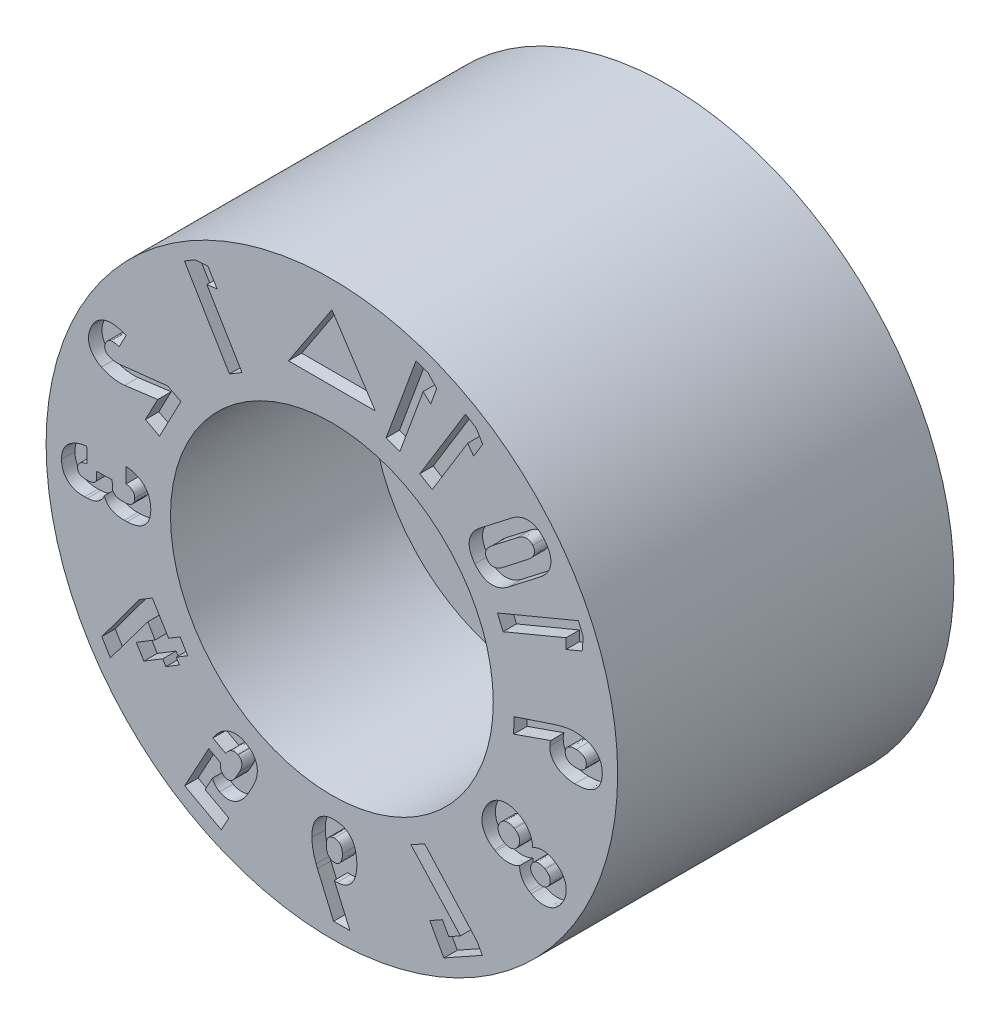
SolidWorks part; units mm, degrees
ref_plane "Front Plane" through (0, 0, 0) normal (0, 0, 1) x (1, 0, 0)
ref_plane "Top Plane" through (0, 0, 0) normal (0, 1, 0) x (1, 0, 0)
ref_plane "Right Plane" through (0, 0, 0) normal (1, 0, 0) x (0, 0, -1)
imported_body "Imported1"
other "Move Face1" parameters "D1"=0.18
other "DeleteFace1"
sketch "Sketch1" plane through (0, 0, 0) normal (0, 0, 1) x (1, 0, 0)
  line L0 (0, 0) -> (5.5475, 3.2028) construction
  line L1 (0, 0) -> (6.4057, 0) construction
  line L2 (0, 0) -> (5.5475, -3.2028) construction
  line L3 (0, 0) -> (3.2028, -5.5475) construction
  line L4 (0, 0) -> (0, -6.4057) construction
  line L5 (0, -2.75) -> (0, 2.75) construction
  line L6 (0, 0) -> (-3.2028, -5.5475) construction
  line L7 (0, 0) -> (-5.5475, -3.2028) construction
  line L8 (0, 0) -> (-6.4057, 0) construction
  line L9 (0, 0) -> (-5.5475, 3.2028) construction
  line L10 (0, 0) -> (-3.2028, 5.5475) construction
  line L11 (0, 0) -> (0, 6.4057) construction
  line L12 (0, 0) -> (3.2028, 5.5475) construction
  line L13 (2.4617, 1.1808) -> (2.5452, 0.981)
  line L14 (2.5452, 0.981) -> (3.483, 1.3721)
  line L15 (3.483, 1.3721) -> (3.4811, 1.2202)
  line L16 (3.4811, 1.2202) -> (3.7222, 1.3209)
  line L17 (3.7222, 1.3209) -> (3.7373, 1.5127)
  line L18 (3.7373, 1.5127) -> (3.666, 1.6833)
  line L19 (3.666, 1.6833) -> (2.4617, 1.1808)
  line L20 (2.6282, 1.5991) -> (3.093, 1.9591)
  line L21 (2.6694, 2.5061) -> (2.2046, 2.146)
  line L22 (2.3873, 2.0116) -> (2.7535, 2.2954)
  line L23 (2.9102, 2.0933) -> (2.544, 1.8095)
  line L24 (1.3075, 2.3967) -> (1.4912, 2.2839)
  line L25 (1.4912, 2.2839) -> (2.02, 3.1459)
  line L26 (2.02, 3.1459) -> (2.1074, 3.0221)
  line L27 (2.1074, 3.0221) -> (2.2434, 3.2438)
  line L28 (2.2434, 3.2438) -> (2.1435, 3.4073)
  line L29 (2.1435, 3.4073) -> (1.9865, 3.5037)
  line L30 (1.9865, 3.5037) -> (1.3075, 2.3967)
  line L31 (0.8067, 2.608) -> (1.0107, 2.5331)
  line L32 (1.0107, 2.5331) -> (1.3579, 3.4801)
  line L33 (1.3579, 3.4801) -> (1.4694, 3.3757)
  line L34 (1.4694, 3.3757) -> (1.5587, 3.6192)
  line L35 (1.5587, 3.6192) -> (1.4269, 3.7603)
  line L36 (1.4269, 3.7603) -> (1.2525, 3.8242)
  line L37 (1.2525, 3.8242) -> (0.8067, 2.608)
  line L38 (-1.5228, 2.2662) -> (-1.3369, 2.3776)
  line L39 (-1.3369, 2.3776) -> (-1.8588, 3.2492)
  line L40 (-1.8588, 3.2492) -> (-1.7076, 3.2695)
  line L41 (-1.7076, 3.2695) -> (-1.8419, 3.4935)
  line L42 (-1.8419, 3.4935) -> (-2.0344, 3.4809)
  line L43 (-2.0344, 3.4809) -> (-2.1933, 3.3857)
  line L44 (-2.1933, 3.3857) -> (-1.5228, 2.2662)
  line L45 (-2.442, 1.6523) -> (-3.1477, 1.575)
  line L46 (-3.3148, 1.5987) -> (-3.3163, 1.5996)
  line L47 (-3.1648, 1.7956) -> (-3.1639, 1.7952)
  line L48 (-3.1639, 1.7952) -> (-3.0603, 1.993)
  line L49 (-3.0603, 1.993) -> (-3.0612, 1.9933)
  line L50 (-3.4268, 1.4042) -> (-3.4259, 1.4039)
  line L51 (-3.0812, 1.3405) -> (-2.5896, 1.4039)
  line L52 (-2.5896, 1.4039) -> (-2.7731, 1.0542)
  line L53 (-2.7731, 1.0542) -> (-2.5632, 0.9441)
  line L54 (-2.5632, 0.9441) -> (-2.2457, 1.5493)
  line L55 (-2.2457, 1.5493) -> (-2.442, 1.6523)
  line L56 (-3.0647, 0.3041) -> (-3.0604, 0.0816)
  line L57 (-3.0778, -0.1676) -> (-3.1082, -0.168)
  line L58 (-3.2649, -0.0665) -> (-3.267, 0.0302)
  line L59 (-3.267, 0.0302) -> (-3.503, 0.0253)
  line L60 (-3.503, 0.0253) -> (-3.5009, -0.0714)
  line L61 (-3.6333, -0.1598) -> (-3.6558, -0.1602)
  line L62 (-3.6412, 0.0517) -> (-3.6457, 0.2734)
  line L63 (-3.676, -0.392) -> (-3.6368, -0.3912)
  line L64 (-3.0847, -0.3991) -> (-3.0455, -0.3983)
  line L65 (-2.8618, -1.3087) -> (-3.4219, -2.0654)
  line L66 (-3.4219, -2.0654) -> (-3.2941, -2.2759)
  line L67 (-3.2941, -2.2759) -> (-2.7381, -1.5328)
  line L68 (-2.7381, -1.5328) -> (-2.6288, -1.7128)
  line L69 (-2.4688, -1.9761) -> (-2.2678, -1.8539)
  line L70 (-2.2678, -1.8539) -> (-2.3148, -1.7765)
  line L71 (-2.6699, -1.1919) -> (-2.8618, -1.3087)
  line L72 (-2.9092, -1.8831) -> (-2.796, -2.069)
  line L73 (-2.796, -2.069) -> (-2.5158, -1.8987)
  line L74 (-2.144, -1.6728) -> (-2.2571, -1.4869)
  line L75 (-2.2571, -1.4869) -> (-2.4277, -1.5906)
  line L76 (-1.7688, -2.5447) -> (-1.7693, -2.5453)
  line L77 (-1.7693, -2.5453) -> (-1.5783, -2.6491)
  line L78 (-1.5783, -2.6491) -> (-1.5778, -2.6484)
  line L79 (-1.3693, -2.7733) -> (-1.4216, -2.8692)
  line L80 (-1.6532, -2.8094) -> (-1.8313, -2.7125)
  line L81 (-1.8313, -2.7125) -> (-2.189, -3.3704)
  line L82 (-2.189, -3.3704) -> (-1.6455, -3.6659)
  line L83 (-1.6455, -3.6659) -> (-1.5325, -3.4581)
  line L84 (-1.5325, -3.4581) -> (-1.8852, -3.2666)
  line L85 (-1.8852, -3.2666) -> (-1.7753, -3.0643)
  line L86 (-1.2306, -2.9729) -> (-1.1784, -2.877)
  line L87 (-0.2978, -3.0916) -> (-0.2978, -3.0924)
  line L88 (-0.2141, -3.4518) -> (0.0247, -4.0087)
  line L89 (0.0247, -4.0087) -> (0.2684, -4.0057)
  line L90 (0.2684, -4.0057) -> (0.0361, -3.4763)
  line L92 (0.3712, -3.0886) -> (0.3712, -3.0878)
  line L93 (0.1557, -3.0753) -> (0.1558, -3.0761)
  line L94 (-0.0827, -3.0782) -> (-0.0827, -3.0771)
  line L95 (2.1581, -3.1991) -> (1.3797, -2.3336)
  line L96 (1.3797, -2.3336) -> (1.1756, -2.4478)
  line L97 (1.1756, -2.4478) -> (1.9112, -3.2533)
  line L98 (1.9112, -3.2533) -> (1.7392, -3.3495)
  line L99 (1.7392, -3.3495) -> (1.6436, -3.1788)
  line L100 (1.6436, -3.1788) -> (1.4551, -3.2842)
  line L101 (1.4551, -3.2842) -> (1.6655, -3.6604)
  line L102 (1.6655, -3.6604) -> (2.2372, -3.3408)
  line L103 (2.2372, -3.3408) -> (2.1581, -3.1991)
  line L104 (2.4166, -1.8898) -> (2.435, -1.9006)
  line L105 (2.9354, -2.1668) -> (2.9645, -2.1839)
  line L106 (3.3104, -1.5948) -> (3.2812, -1.5777)
  line L107 (2.8049, -1.2704) -> (2.7865, -1.2596)
  line L108 (2.7073, -1.465) -> (2.718, -1.4714)
  line L109 (2.5673, -1.7264) -> (2.5557, -1.7196)
  line L110 (3.163, -1.7601) -> (3.1737, -1.7664)
  line L111 (3.047, -1.9804) -> (3.0354, -1.9735)
  line L113 (3.6121, -0.4436) -> (3.6129, -0.4437)
  line L114 (3.6288, 0.2258) -> (3.628, 0.2256)
  line L115 (3.2724, 0.1562) -> (2.7091, -0.0312)
  line L116 (2.7091, -0.0312) -> (2.7022, -0.2593)
  line L117 (2.7022, -0.2593) -> (3.2542, -0.0658)
  line L118 (3.633, 0.01) -> (3.6338, 0.01)
  line L119 (3.6259, -0.2284) -> (3.6248, -0.2283)
  line L120 (-2.4277, -1.5906) -> (-2.6699, -1.1919)
  line L121 (-2.3148, -1.7765) -> (-2.144, -1.6728)
  line L122 (-2.6288, -1.7128) -> (-2.9092, -1.8831)
  line L123 (-2.5158, -1.8987) -> (-2.4688, -1.9761)
  circle A0 centre (0, 0) radius 2.74 construction
  spline S0 degree 3 poles (2.1259, 1.6475) (2.1424, 1.6265) (2.1681, 1.5971) (2.2068, 1.5643) (2.2359, 1.5444) (2.2657, 1.5279) (2.2964, 1.5155) (2.3283, 1.5074) (2.3607, 1.5027) (2.3937, 1.5023) (2.4269, 1.5052) (2.4603, 1.5117) (2.4937, 1.5222) (2.5274, 1.5358) (2.5735, 1.5599) (2.6066, 1.5824) (2.6282, 1.5991) knots 0 0 0 0 0.139264 0.203206 0.264472 0.322969 0.380626 0.437349 0.493979 0.55136 0.609121 0.667907 0.728572 0.791843 0.857485 1 1 1 1
  spline S1 degree 3 poles (3.093, 1.9591) (3.1148, 1.976) (3.1452, 2.0026) (3.1803, 2.0416) (3.2022, 2.0708) (3.2205, 2.1007) (3.235, 2.1314) (3.2464, 2.1627) (3.2535, 2.1948) (3.2571, 2.2272) (3.2567, 2.2599) (3.2525, 2.2928) (3.2442, 2.3257) (3.2318, 2.3588) (3.2095, 2.4041) (3.1879, 2.4365) (3.1716, 2.4574) knots 0 0 0 0 0.143911 0.210291 0.273547 0.334208 0.392877 0.450716 0.507441 0.564283 0.620638 0.677728 0.736513 0.797761 0.861505 1 1 1 1
  spline S2 degree 3 poles (3.1716, 2.4574) (3.1552, 2.4784) (3.1293, 2.5077) (3.0908, 2.5408) (3.0619, 2.5611) (3.0321, 2.5773) (3.0014, 2.5898) (2.9699, 2.5982) (2.9377, 2.6031) (2.9049, 2.6037) (2.8719, 2.601) (2.8386, 2.5944) (2.8049, 2.5842) (2.7711, 2.5701) (2.7245, 2.5458) (2.6911, 2.5231) (2.6694, 2.5061) knots 0 0 0 0 0.139092 0.203155 0.264071 0.322941 0.380071 0.436264 0.492774 0.549529 0.606631 0.665344 0.726326 0.789796 0.856006 1 1 1 1
  spline S3 degree 3 poles (2.2046, 2.146) (2.1828, 2.1293) (2.1526, 2.1027) (2.1176, 2.0637) (2.0956, 2.0345) (2.0773, 2.0045) (2.0627, 1.9737) (2.0514, 1.9423) (2.0442, 1.9101) (2.0407, 1.8776) (2.0411, 1.8449) (2.0452, 1.8121) (2.0535, 1.7791) (2.0659, 1.7461) (2.0879, 1.7006) (2.1097, 1.6685) (2.1259, 1.6475) knots 0 0 0 0 0.143281 0.209664 0.272921 0.334025 0.392696 0.450537 0.507724 0.564568 0.620925 0.678017 0.736803 0.798054 0.861501 1 1 1 1
  spline S4 degree 3 poles (2.3115, 1.7912) (2.2992, 1.8065) (2.2856, 1.8331) (2.2842, 1.8717) (2.2913, 1.8999) (2.3057, 1.928) (2.3354, 1.9683) (2.3657, 1.9942) (2.3873, 2.0116) knots 0 0 0 0 0.224242 0.325931 0.433422 0.551417 0.683099 1 1 1 1
  spline S5 degree 3 poles (2.7535, 2.2954) (2.7755, 2.3126) (2.8087, 2.3346) (2.8549, 2.3536) (2.8856, 2.3604) (2.9148, 2.3603) (2.9518, 2.349) (2.9743, 2.3295) (2.9859, 2.3137) knots 0 0 0 0 0.318022 0.448766 0.56642 0.673823 0.776322 1 1 1 1
  spline S6 degree 3 poles (2.9859, 2.3137) (2.998, 2.2984) (3.0121, 2.2719) (3.0133, 2.2332) (3.0062, 2.205) (2.9917, 2.177) (2.962, 2.1369) (2.9323, 2.1103) (2.9102, 2.0933) knots 0 0 0 0 0.223374 0.326015 0.433495 0.550497 0.682165 1 1 1 1
  spline S7 degree 3 poles (2.544, 1.8095) (2.5221, 1.7923) (2.4889, 1.7705) (2.4427, 1.7513) (2.4118, 1.7445) (2.3827, 1.7446) (2.3457, 1.7559) (2.3232, 1.7754) (2.3115, 1.7912) knots 0 0 0 0 0.316607 0.448757 0.566413 0.673818 0.776319 1 1 1 1
  spline S8 degree 3 poles (-3.1477, 1.575) (-3.1781, 1.5709) (-3.2356, 1.5713) (-3.2912, 1.5864) (-3.3148, 1.5987) knots 0 0 0 0 0.53629 1 1 1 1
  spline S9 degree 3 poles (-3.3163, 1.5996) (-3.3306, 1.6067) (-3.3494, 1.6205) (-3.3676, 1.6446) (-3.3752, 1.6642) (-3.379, 1.6851) (-3.3766, 1.7161) (-3.368, 1.7389) (-3.3601, 1.7535) knots 0 0 0 0 0.262069 0.378526 0.491859 0.605797 0.72603 1 1 1 1
  spline S10 degree 3 poles (-3.3601, 1.7535) (-3.3527, 1.7685) (-3.3366, 1.788) (-3.3082, 1.8056) (-3.2839, 1.8132) (-3.2569, 1.8164) (-3.2161, 1.8132) (-3.1852, 1.8043) (-3.1648, 1.7956) knots 0 0 0 0 0.225503 0.334502 0.448026 0.568399 0.699521 1 1 1 1
  spline S11 degree 3 poles (-3.0612, 1.9933) (-3.096, 2.0092) (-3.1488, 2.0281) (-3.2201, 2.042) (-3.2703, 2.0458) (-3.3184, 2.0434) (-3.364, 2.0351) (-3.4068, 2.0209) (-3.4468, 2.0009) (-3.4834, 1.9748) (-3.5284, 1.9324) (-3.5546, 1.893) (-3.5694, 1.865) knots 0 0 0 0 0.196173 0.28577 0.371707 0.453588 0.531973 0.608304 0.68414 0.760168 0.837544 1 1 1 1
  spline S12 degree 3 poles (-3.5694, 1.865) (-3.5852, 1.8353) (-3.6037, 1.7896) (-3.6174, 1.7274) (-3.6207, 1.6833) (-3.618, 1.6407) (-3.6088, 1.5998) (-3.5934, 1.5611) (-3.5718, 1.5243) (-3.544, 1.49) (-3.498, 1.446) (-3.4564, 1.4198) (-3.4268, 1.4042) knots 0 0 0 0 0.184045 0.267802 0.347881 0.425458 0.500482 0.575862 0.652921 0.732871 0.816751 1 1 1 1
  spline S13 degree 3 poles (-3.4259, 1.4039) (-3.3995, 1.3904) (-3.3586, 1.3723) (-3.3014, 1.3553) (-3.2571, 1.3459) (-3.2126, 1.3389) (-3.1538, 1.3352) (-3.11, 1.3367) (-3.0812, 1.3405) knots 0 0 0 0 0.249796 0.37589 0.503414 0.630939 0.755521 1 1 1 1
  spline S14 degree 3 poles (-2.6934, -0.0551) (-2.6939, -0.0221) (-2.7, 0.0264) (-2.7194, 0.0875) (-2.7392, 0.1291) (-2.7639, 0.1674) (-2.7936, 0.2016) (-2.8285, 0.2311) (-2.8676, 0.2567) (-2.9115, 0.2768) (-2.9767, 0.2976) (-3.0292, 0.3029) (-3.0647, 0.3041) knots 0 0 0 0 0.170915 0.251711 0.331349 0.409597 0.487148 0.565266 0.646102 0.729077 0.814865 1 1 1 1
  spline S15 degree 3 poles (-3.0604, 0.0816) (-3.0479, 0.0799) (-3.0294, 0.0772) (-3.0068, 0.0693) (-2.9917, 0.0623) (-2.9785, 0.0537) (-2.9664, 0.0444) (-2.9561, 0.0336) (-2.9476, 0.0216) (-2.9406, 0.0087) (-2.9342, -0.0105) (-2.9317, -0.0257) (-2.9317, -0.0362) knots 0 0 0 0 0.197555 0.28767 0.373146 0.455135 0.533119 0.610067 0.685564 0.761808 0.837915 1 1 1 1
  spline S16 degree 3 poles (-2.9317, -0.0362) (-2.9317, -0.0546) (-2.9346, -0.0822) (-2.9513, -0.1137) (-2.9686, -0.1327) (-2.99, -0.1482) (-3.0263, -0.1631) (-3.0566, -0.1675) (-3.0778, -0.1676) knots 0 0 0 0 0.249641 0.362623 0.475304 0.592053 0.715501 1 1 1 1
  spline S17 degree 3 poles (-3.1082, -0.168) (-3.1303, -0.1687) (-3.1618, -0.1665) (-3.2003, -0.1557) (-3.2231, -0.1442) (-3.2415, -0.1294) (-3.2599, -0.1049) (-3.2643, -0.0817) (-3.2649, -0.0665) knots 0 0 0 0 0.314439 0.447609 0.567871 0.677707 0.781218 1 1 1 1
  spline S18 degree 3 poles (-3.5009, -0.0714) (-3.5005, -0.084) (-3.5045, -0.1032) (-3.5198, -0.1238) (-3.5354, -0.1363) (-3.5547, -0.1467) (-3.5875, -0.1566) (-3.6144, -0.1596) (-3.6333, -0.1598) knots 0 0 0 0 0.212717 0.315296 0.425563 0.547852 0.681966 1 1 1 1
  spline S19 degree 3 poles (-3.6558, -0.1602) (-3.6736, -0.1604) (-3.6994, -0.1591) (-3.7304, -0.1488) (-3.7489, -0.1381) (-3.7638, -0.1246) (-3.7787, -0.1022) (-3.7828, -0.082) (-3.7829, -0.0684) knots 0 0 0 0 0.302489 0.430837 0.549934 0.662062 0.76879 1 1 1 1
  spline S20 degree 3 poles (-3.7829, -0.0684) (-3.7835, -0.0588) (-3.7808, -0.0449) (-3.7745, -0.0271) (-3.7672, -0.0146) (-3.7578, -0.0029) (-3.7468, 0.0081) (-3.7334, 0.0178) (-3.7184, 0.027) (-3.7015, 0.035) (-3.6759, 0.0445) (-3.6553, 0.049) (-3.6412, 0.0517) knots 0 0 0 0 0.140018 0.20799 0.27907 0.353221 0.429103 0.509956 0.596543 0.689056 0.786611 1 1 1 1
  spline S21 degree 3 poles (-3.6457, 0.2734) (-3.6831, 0.2697) (-3.7374, 0.2601) (-3.8049, 0.2363) (-3.8497, 0.2143) (-3.8899, 0.1883) (-3.925, 0.1586) (-3.9552, 0.1255) (-3.9797, 0.0889) (-3.9986, 0.0494) (-4.0169, -0.0067) (-4.0211, -0.0513) (-4.0205, -0.081) knots 0 0 0 0 0.196756 0.287394 0.374446 0.457889 0.537714 0.61497 0.691823 0.767827 0.843846 1 1 1 1
  spline S22 degree 3 poles (-4.0205, -0.081) (-4.02, -0.105) (-4.0171, -0.1401) (-4.0064, -0.1847) (-3.9963, -0.215) (-3.9834, -0.2432) (-3.9677, -0.2693) (-3.9491, -0.293) (-3.928, -0.3145) (-3.9043, -0.3334) (-3.8784, -0.35) (-3.85, -0.3636) (-3.8196, -0.375) (-3.7869, -0.3833) (-3.739, -0.3913) (-3.7015, -0.3923) (-3.676, -0.392) knots 0 0 0 0 0.1363 0.199178 0.259829 0.317878 0.37514 0.431951 0.488787 0.546041 0.604081 0.663346 0.724289 0.788255 0.854873 1 1 1 1
  spline S23 degree 3 poles (-3.6368, -0.3912) (-3.6085, -0.3905) (-3.5665, -0.3856) (-3.5148, -0.367) (-3.4799, -0.3489) (-3.4489, -0.326) (-3.4124, -0.2896) (-3.3925, -0.2559) (-3.3824, -0.232) knots 0 0 0 0 0.268071 0.393627 0.516103 0.636592 0.755557 1 1 1 1
  spline S24 degree 3 poles (-3.3824, -0.232) (-3.3785, -0.2452) (-3.3716, -0.2647) (-3.3578, -0.2883) (-3.3461, -0.3048) (-3.3324, -0.3199) (-3.317, -0.3337) (-3.3001, -0.3465) (-3.2749, -0.362) (-3.2395, -0.378) (-3.1739, -0.3961) (-3.1211, -0.4001) (-3.0847, -0.3991) knots 0 0 0 0 0.112304 0.166591 0.221569 0.276649 0.332004 0.38966 0.448621 0.572598 0.704095 1 1 1 1
  spline S25 degree 3 poles (-3.0455, -0.3983) (-3.0103, -0.3976) (-2.9589, -0.3924) (-2.8947, -0.3742) (-2.8525, -0.356) (-2.8147, -0.3332) (-2.7816, -0.3059) (-2.7537, -0.2739) (-2.731, -0.2376) (-2.7131, -0.1974) (-2.6964, -0.1366) (-2.6926, -0.0881) (-2.6934, -0.0551) knots 0 0 0 0 0.189492 0.275414 0.357234 0.435772 0.51156 0.586704 0.662739 0.741001 0.822287 1 1 1 1
  spline S26 degree 3 poles (-1.286, -2.3634) (-1.3119, -2.3488) (-1.3536, -2.333) (-1.4115, -2.3238) (-1.4548, -2.3234) (-1.4982, -2.3291) (-1.5411, -2.3414) (-1.5833, -2.3601) (-1.6243, -2.3853) (-1.6641, -2.4164) (-1.7156, -2.4674) (-1.7487, -2.5123) (-1.7688, -2.5447) knots 0 0 0 0 0.155357 0.230238 0.305532 0.381121 0.458378 0.53785 0.62191 0.709523 0.800975 1 1 1 1
  spline S27 degree 3 poles (-1.5778, -2.6484) (-1.5655, -2.6307) (-1.5465, -2.6056) (-1.5149, -2.5809) (-1.4914, -2.5685) (-1.4675, -2.561) (-1.4349, -2.5589) (-1.4112, -2.5662) (-1.3971, -2.5742) knots 0 0 0 0 0.300378 0.430531 0.552154 0.666768 0.774669 1 1 1 1
  spline S28 degree 3 poles (-1.3971, -2.5742) (-1.3817, -2.5823) (-1.3613, -2.5989) (-1.3451, -2.629) (-1.3388, -2.6539) (-1.3379, -2.6813) (-1.3451, -2.7227) (-1.3582, -2.7531) (-1.3693, -2.7733) knots 0 0 0 0 0.229451 0.336013 0.447885 0.566223 0.695184 1 1 1 1
  spline S29 degree 3 poles (-1.4216, -2.8692) (-1.4323, -2.8893) (-1.4503, -2.9167) (-1.4797, -2.9458) (-1.5017, -2.9605) (-1.5243, -2.9698) (-1.5555, -2.973) (-1.5784, -2.9669) (-1.5919, -2.959) knots 0 0 0 0 0.3165 0.449949 0.571115 0.681043 0.785033 1 1 1 1
  spline S30 degree 3 poles (-1.5919, -2.959) (-1.6046, -2.9519) (-1.6226, -2.9391) (-1.6398, -2.9162) (-1.6497, -2.8977) (-1.6557, -2.8772) (-1.6597, -2.8475) (-1.6569, -2.8245) (-1.6532, -2.8094) knots 0 0 0 0 0.251575 0.369942 0.488434 0.609601 0.733459 1 1 1 1
  spline S31 degree 3 poles (-1.7753, -3.0643) (-1.7724, -3.0766) (-1.7645, -3.0946) (-1.7504, -3.1172) (-1.7369, -3.134) (-1.7217, -3.1497) (-1.7002, -3.1688) (-1.6826, -3.1809) (-1.6701, -3.1875) knots 0 0 0 0 0.227923 0.350723 0.482106 0.615334 0.746107 1 1 1 1
  spline S32 degree 3 poles (-1.6701, -3.1875) (-1.6457, -3.2012) (-1.6067, -3.2161) (-1.5526, -3.223) (-1.513, -3.221) (-1.4738, -3.2122) (-1.4354, -3.1968) (-1.3979, -3.1749) (-1.3613, -3.1467) (-1.3262, -3.1119) (-1.2794, -3.0556) (-1.2493, -3.0073) (-1.2306, -2.9729) knots 0 0 0 0 0.152182 0.224111 0.295102 0.366811 0.441203 0.519083 0.602421 0.691597 0.787124 1 1 1 1
  spline S33 degree 3 poles (-1.1784, -2.877) (-1.1602, -2.8423) (-1.1356, -2.7904) (-1.1168, -2.7189) (-1.1093, -2.669) (-1.1083, -2.621) (-1.1145, -2.5755) (-1.1268, -2.5323) (-1.146, -2.4919) (-1.1717, -2.4544) (-1.2153, -2.4071) (-1.2567, -2.3795) (-1.286, -2.3634) knots 0 0 0 0 0.198012 0.287153 0.37167 0.451892 0.528131 0.602464 0.676978 0.752647 0.830779 1 1 1 1
  spline S34 degree 3 poles (0.0318, -2.6949) (-0.0012, -2.6949) (-0.0493, -2.701) (-0.1092, -2.7211) (-0.1487, -2.7422) (-0.1842, -2.7683) (-0.2152, -2.8) (-0.2411, -2.8371) (-0.2624, -2.8791) (-0.2789, -2.9259) (-0.2952, -2.9967) (-0.2981, -3.053) (-0.2978, -3.0916) knots 0 0 0 0 0.168766 0.246642 0.322553 0.397273 0.471855 0.548534 0.628334 0.712731 0.801986 1 1 1 1
  spline S35 degree 3 poles (-0.2978, -3.0924) (-0.2975, -3.1167) (-0.295, -3.1537) (-0.2883, -3.2034) (-0.273, -3.2825) (-0.2545, -3.3479) (-0.2352, -3.3991) knots 0 0 0 0 0.231959 0.353197 0.478693 1 1 1 1
  spline S36 degree 3 poles (-0.2352, -3.3991) (-0.2323, -3.4083) (-0.2252, -3.4259) (-0.2179, -3.4434) (-0.2141, -3.4518) knots 0 0 0 0 0.508512 1 1 1 1
  spline S37 degree 3 poles (0.0361, -3.4763) (0.0499, -3.4794) (0.064, -3.4807) (0.0781, -3.4805) knots 0.765711 0.765711 0.765711 0.765711 1 1 1 1
  spline S38 degree 3 poles (0.0781, -3.4805) (0.1075, -3.48) (0.151, -3.4748) (0.2042, -3.4545) (0.2394, -3.4338) (0.2711, -3.408) (0.2978, -3.3762) (0.3216, -3.3401) (0.3401, -3.2984) (0.355, -3.2523) (0.3686, -3.1821) (0.3717, -3.1267) (0.3712, -3.0886) knots 0 0 0 0 0.159826 0.233979 0.30722 0.380154 0.45434 0.531445 0.613402 0.700561 0.793767 1 1 1 1
  spline S39 degree 3 poles (0.3712, -3.0878) (0.3712, -3.0488) (0.3656, -2.9923) (0.3486, -2.9209) (0.3307, -2.874) (0.3084, -2.8319) (0.2812, -2.7952) (0.2498, -2.7637) (0.2137, -2.7382) (0.1737, -2.718) (0.1133, -2.6988) (0.0648, -2.6943) (0.0318, -2.6949) knots 0 0 0 0 0.198581 0.287923 0.37282 0.453452 0.529919 0.604649 0.678836 0.754265 0.831904 1 1 1 1
  spline S40 degree 3 poles (0.0346, -2.9309) (0.0518, -2.9305) (0.0775, -2.9343) (0.1068, -2.9507) (0.1243, -2.9676) (0.1384, -2.9887) (0.152, -3.0246) (0.1556, -3.0545) (0.1557, -3.0753) knots 0 0 0 0 0.242651 0.353813 0.465986 0.581856 0.70733 1 1 1 1
  spline S41 degree 3 poles (0.1558, -3.0761) (0.1561, -3.1) (0.1536, -3.1344) (0.1406, -3.1759) (0.1274, -3.2006) (0.1102, -3.2204) (0.0816, -3.2398) (0.0555, -3.2446) (0.0382, -3.2449) knots 0 0 0 0 0.309802 0.440421 0.559006 0.6696 0.775302 1 1 1 1
  spline S42 degree 3 poles (0.0382, -3.2449) (0.0211, -3.245) (-0.005, -3.2405) (-0.0337, -3.2214) (-0.0512, -3.2016) (-0.0653, -3.1771) (-0.079, -3.1359) (-0.0828, -3.1019) (-0.0827, -3.0782) knots 0 0 0 0 0.223197 0.329061 0.440845 0.562032 0.692834 1 1 1 1
  spline S43 degree 3 poles (-0.0827, -3.0771) (-0.0828, -3.0565) (-0.0806, -3.0265) (-0.0674, -2.9907) (-0.0536, -2.9694) (-0.0367, -2.9519) (-0.0077, -2.9355) (0.0174, -2.9306) (0.0346, -2.9309) knots 0 0 0 0 0.292568 0.417776 0.535306 0.647259 0.758264 1 1 1 1
  spline S44 degree 3 poles (2.2914, -1.3926) (2.2742, -1.4224) (2.2523, -1.4686) (2.2365, -1.5333) (2.2316, -1.5804) (2.233, -1.6268) (2.2409, -1.6716) (2.255, -1.7148) (2.2759, -1.7558) (2.3024, -1.7944) (2.3466, -1.843) (2.3872, -1.8728) (2.4166, -1.8898) knots 0 0 0 0 0.179216 0.263098 0.344899 0.424707 0.503046 0.580641 0.659998 0.740899 0.823451 1 1 1 1
  spline S45 degree 3 poles (2.435, -1.9006) (2.4623, -1.9165) (2.5061, -1.936) (2.5685, -1.9489) (2.6162, -1.9529) (2.6635, -1.951) (2.7239, -1.9407) (2.7662, -1.9232) (2.7921, -1.9081) knots 0 0 0 0 0.254268 0.380657 0.509625 0.637065 0.759654 1 1 1 1
  spline S46 degree 3 poles (2.7921, -1.9081) (2.7912, -1.9335) (2.7952, -1.9721) (2.8112, -2.0213) (2.8283, -2.0567) (2.8492, -2.0901) (2.8826, -2.1298) (2.9132, -2.1538) (2.9354, -2.1668) knots 0 0 0 0 0.24673 0.371571 0.49906 0.626963 0.75144 1 1 1 1
  spline S47 degree 3 poles (2.9645, -2.1839) (2.992, -2.2005) (3.0353, -2.2198) (3.0955, -2.2344) (3.1396, -2.2384) (3.1829, -2.2366) (3.2251, -2.2292) (3.2656, -2.2153) (3.3042, -2.1956) (3.3404, -2.17) (3.3866, -2.1283) (3.414, -2.089) (3.4307, -2.0615) knots 0 0 0 0 0.177147 0.260228 0.341479 0.421197 0.498869 0.57737 0.656946 0.738211 0.821577 1 1 1 1
  spline S48 degree 3 poles (3.4307, -2.0615) (3.447, -2.0336) (3.4673, -1.9903) (3.4817, -1.9296) (3.4862, -1.8853) (3.4843, -1.842) (3.477, -1.7999) (3.463, -1.7596) (3.4437, -1.7208) (3.4181, -1.6847) (3.3765, -1.6389) (3.3379, -1.6112) (3.3104, -1.5948) knots 0 0 0 0 0.178529 0.262288 0.343793 0.423501 0.501162 0.579171 0.658741 0.739995 0.822879 1 1 1 1
  spline S49 degree 3 poles (3.2812, -1.5777) (3.2587, -1.5645) (3.2223, -1.549) (3.1707, -1.5394) (3.1312, -1.5372) (3.092, -1.5404) (3.0413, -1.5512) (3.0059, -1.5672) (2.9842, -1.5809) knots 0 0 0 0 0.250821 0.376045 0.503213 0.630355 0.753567 1 1 1 1
  spline S50 degree 3 poles (2.9842, -1.5809) (2.985, -1.5506) (2.9796, -1.5046) (2.9595, -1.4462) (2.9383, -1.4036) (2.9118, -1.3638) (2.87, -1.3158) (2.8321, -1.2865) (2.8049, -1.2704) knots 0 0 0 0 0.242088 0.365569 0.492638 0.621173 0.746831 1 1 1 1
  spline S51 degree 3 poles (2.7865, -1.2596) (2.7572, -1.2424) (2.7115, -1.2215) (2.6477, -1.2061) (2.601, -1.2017) (2.5551, -1.204) (2.5103, -1.2122) (2.4673, -1.2274) (2.4262, -1.2488) (2.3873, -1.2761) (2.3388, -1.3216) (2.3087, -1.3628) (2.2914, -1.3926) knots 0 0 0 0 0.176243 0.259184 0.339856 0.419086 0.497161 0.575461 0.655277 0.737212 0.821016 1 1 1 1
  spline S52 degree 3 poles (2.4942, -1.5116) (2.501, -1.4996) (2.5135, -1.4831) (2.5338, -1.4652) (2.5502, -1.4545) (2.5679, -1.4466) (2.5865, -1.4413) (2.6058, -1.4384) (2.6259, -1.4383) (2.6463, -1.4408) (2.6742, -1.4482) (2.6944, -1.4574) (2.7073, -1.465) knots 0 0 0 0 0.169084 0.25034 0.329596 0.408608 0.485757 0.565732 0.646931 0.730867 0.81658 1 1 1 1
  spline S53 degree 3 poles (2.718, -1.4714) (2.7298, -1.4785) (2.7466, -1.4902) (2.7642, -1.5102) (2.7751, -1.5258) (2.7835, -1.5425) (2.7891, -1.56) (2.7926, -1.5781) (2.7932, -1.5968) (2.7909, -1.6157) (2.7849, -1.642) (2.776, -1.6608) (2.769, -1.6729) knots 0 0 0 0 0.17653 0.259469 0.340507 0.419778 0.497778 0.575867 0.654879 0.736532 0.820048 1 1 1 1
  spline S54 degree 3 poles (2.769, -1.6729) (2.7622, -1.6852) (2.7497, -1.7015) (2.7303, -1.7201) (2.7144, -1.7308) (2.6979, -1.7397) (2.6801, -1.7453) (2.6619, -1.7489) (2.6431, -1.7495) (2.624, -1.7478) (2.5979, -1.742) (2.5792, -1.7335) (2.5673, -1.7264) knots 0 0 0 0 0.178479 0.261705 0.342454 0.422562 0.500282 0.579174 0.658923 0.740613 0.823101 1 1 1 1
  spline S55 degree 3 poles (2.5557, -1.7196) (2.543, -1.712) (2.5249, -1.6993) (2.5055, -1.6781) (2.4934, -1.6617) (2.4836, -1.6444) (2.4769, -1.626) (2.4728, -1.6072) (2.4715, -1.5879) (2.4728, -1.5684) (2.479, -1.5422) (2.487, -1.5234) (2.4942, -1.5116) knots 0 0 0 0 0.182942 0.268589 0.352164 0.433659 0.512476 0.591262 0.670564 0.749552 0.830495 1 1 1 1
  spline S56 degree 3 poles (2.9733, -1.793) (2.9791, -1.7827) (2.9899, -1.7689) (3.0075, -1.7539) (3.0219, -1.7453) (3.0373, -1.7388) (3.0537, -1.7348) (3.071, -1.7332) (3.0889, -1.7337) (3.1073, -1.7369) (3.1327, -1.7441) (3.151, -1.7532) (3.163, -1.7601) knots 0 0 0 0 0.163447 0.241168 0.318358 0.394417 0.472416 0.551434 0.634096 0.719691 0.808786 1 1 1 1
  spline S57 degree 3 poles (3.1737, -1.7664) (3.1848, -1.7729) (3.2003, -1.7838) (3.2173, -1.8016) (3.2278, -1.8154) (3.236, -1.8302) (3.2423, -1.8453) (3.2459, -1.8613) (3.2472, -1.8775) (3.2461, -1.894) (3.2413, -1.9164) (3.2343, -1.9325) (3.2283, -1.9426) knots 0 0 0 0 0.185745 0.270933 0.355052 0.435482 0.514964 0.591407 0.670324 0.749323 0.830035 1 1 1 1
  spline S58 degree 3 poles (3.2283, -1.9426) (3.2222, -1.9526) (3.2121, -1.9669) (3.1945, -1.9816) (3.1808, -1.9906) (3.1659, -1.9974) (3.1502, -2.0019) (3.1338, -2.004) (3.1168, -2.0039) (3.0993, -2.0015) (3.0753, -1.9952) (3.0581, -1.9869) (3.047, -1.9804) knots 0 0 0 0 0.169191 0.248749 0.32793 0.405565 0.483346 0.561758 0.643638 0.727574 0.814879 1 1 1 1
  spline S59 degree 3 poles (3.0354, -1.9735) (3.0238, -1.9668) (3.0073, -1.9554) (2.9892, -1.9367) (2.9778, -1.9222) (2.9683, -1.9072) (2.9617, -1.8913) (2.9571, -1.8751) (2.9555, -1.8585) (2.956, -1.8418) (2.9601, -1.8192) (2.9675, -1.8033) (2.9733, -1.793) knots 0 0 0 0 0.188514 0.277547 0.363009 0.445945 0.52519 0.602181 0.68035 0.758286 0.83483 1 1 1 1
  spline S61 degree 3 poles (3.2401, -0.142) (3.2395, -0.1694) (3.2432, -0.2104) (3.262, -0.2612) (3.2819, -0.2961) (3.3073, -0.3281) (3.3379, -0.3564) (3.3734, -0.3814) (3.4135, -0.4025) (3.4579, -0.4198) (3.5241, -0.4369) (3.5764, -0.4427) (3.6121, -0.4436) knots 0 0 0 0 0.153266 0.227117 0.301348 0.376882 0.454393 0.534003 0.618635 0.707332 0.800006 1 1 1 1
  spline S62 degree 3 poles (3.6129, -0.4437) (3.652, -0.4447) (3.7092, -0.4427) (3.7814, -0.4277) (3.8292, -0.4121) (3.8722, -0.3915) (3.9102, -0.3662) (3.9427, -0.3358) (3.97, -0.301) (3.9917, -0.2617) (4.0133, -0.2021) (4.0201, -0.1536) (4.0209, -0.1205) knots 0 0 0 0 0.198831 0.289037 0.373579 0.453698 0.530492 0.604734 0.678889 0.753925 0.831688 1 1 1 1
  spline S63 degree 3 poles (4.0209, -0.1205) (4.0217, -0.0878) (4.0185, -0.0392) (4, 0.0213) (3.9801, 0.0615) (3.9547, 0.0981) (3.9233, 0.1301) (3.8866, 0.1581) (3.8444, 0.1813) (3.7972, 0.1995) (3.7256, 0.2191) (3.6681, 0.2241) (3.6288, 0.2258) knots 0 0 0 0 0.166131 0.243477 0.318517 0.392625 0.467585 0.544543 0.625283 0.710345 0.800254 1 1 1 1
  spline S64 degree 3 poles (3.628, 0.2256) (3.6053, 0.2267) (3.5704, 0.225) (3.5233, 0.2199) (3.4859, 0.2139) (3.4472, 0.2056) (3.3921, 0.1928) (3.3503, 0.1807) (3.3219, 0.1721) knots 0 0 0 0 0.218335 0.334597 0.455504 0.58216 0.715113 1 1 1 1
  spline S65 degree 3 poles (3.3219, 0.1721) (3.3135, 0.1695) (3.2967, 0.165) (3.2804, 0.1592) (3.2724, 0.1562) knots 0 0 0 0 0.509082 1 1 1 1
  spline S66 degree 3 poles (3.4701, -0.1038) (3.4705, -0.0867) (3.4762, -0.0614) (3.495, -0.0332) (3.5143, -0.0165) (3.538, -0.0035) (3.5776, 0.009) (3.6105, 0.0102) (3.633, 0.01) knots 0 0 0 0 0.22935 0.336268 0.448142 0.567043 0.696404 1 1 1 1
  spline S67 degree 3 poles (3.6338, 0.01) (3.6556, 0.0089) (3.687, 0.0057) (3.7242, -0.0092) (3.7461, -0.0237) (3.7635, -0.0415) (3.7801, -0.0707) (3.7837, -0.0963) (3.783, -0.1134) knots 0 0 0 0 0.29936 0.427133 0.544775 0.656915 0.765292 1 1 1 1
  spline S68 degree 3 poles (3.783, -0.1134) (3.7829, -0.1307) (3.7774, -0.1563) (3.759, -0.185) (3.7402, -0.2018) (3.7173, -0.2148) (3.6792, -0.2275) (3.6476, -0.2289) (3.6259, -0.2284) knots 0 0 0 0 0.236511 0.345744 0.457898 0.575861 0.703033 1 1 1 1
  spline S69 degree 3 poles (3.6248, -0.2283) (3.6023, -0.2274) (3.5697, -0.2243) (3.5312, -0.2092) (3.5084, -0.1949) (3.4903, -0.1769) (3.4734, -0.1471) (3.4695, -0.1212) (3.4701, -0.1038) knots 0 0 0 0 0.302289 0.43018 0.54894 0.659981 0.767245 1 1 1 1
  spline S70 degree 3 poles (3.2542, -0.0658) (3.2538, -0.0669) (3.2507, -0.0752) (3.2433, -0.1002) (3.2404, -0.125) (3.2401, -0.142) knots 0.574653 0.574653 0.574653 0.574653 0.593345 0.721146 1 1 1 1
  point P21 (0, 0)
  dimension "D1" = 12
  dimension "D2" = 60
extrude "Cut-Extrude1" cut sketch "Sketch1" against normal blind 0.2
